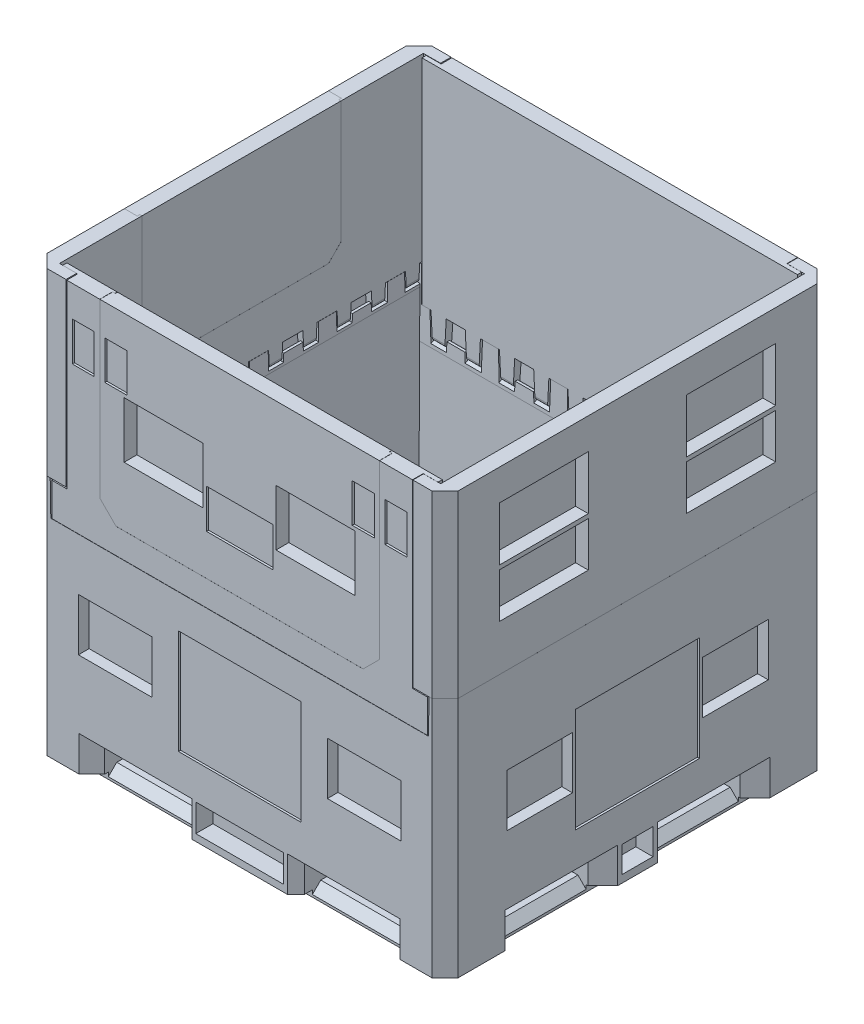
SolidWorks part; units mm, degrees
other "109288SM[1]"
other "109379SM[1]"
other "109378SM[1]"
other "109370SM[1]"
other "109380SM[1]"
other "109381SM[1]"
other "109382SM[1]"
ref_plane "Front" through (0, 0, 0) normal (0, 0, 1) x (1, 0, 0)
ref_plane "Top" through (0, 0, 0) normal (0, 1, 0) x (1, 0, 0)
ref_plane "Right" through (0, 0, 0) normal (1, 0, 0) x (0, 0, -1)
imported_body "Imported1"
imported_body "Imported2"
imported_body "Imported3"
imported_body "Imported4"
imported_body "Imported5"
imported_body "Imported6"
imported_body "Imported7"
shell "Shell1" thickness 6.096
shell "Shell2" thickness 5.08
shell "Shell3" thickness 5.08
shell "Shell4" thickness 5.08
shell "Shell5" thickness 5.08
shell "Shell6" thickness 5.08
shell "Shell7" thickness 5.08
